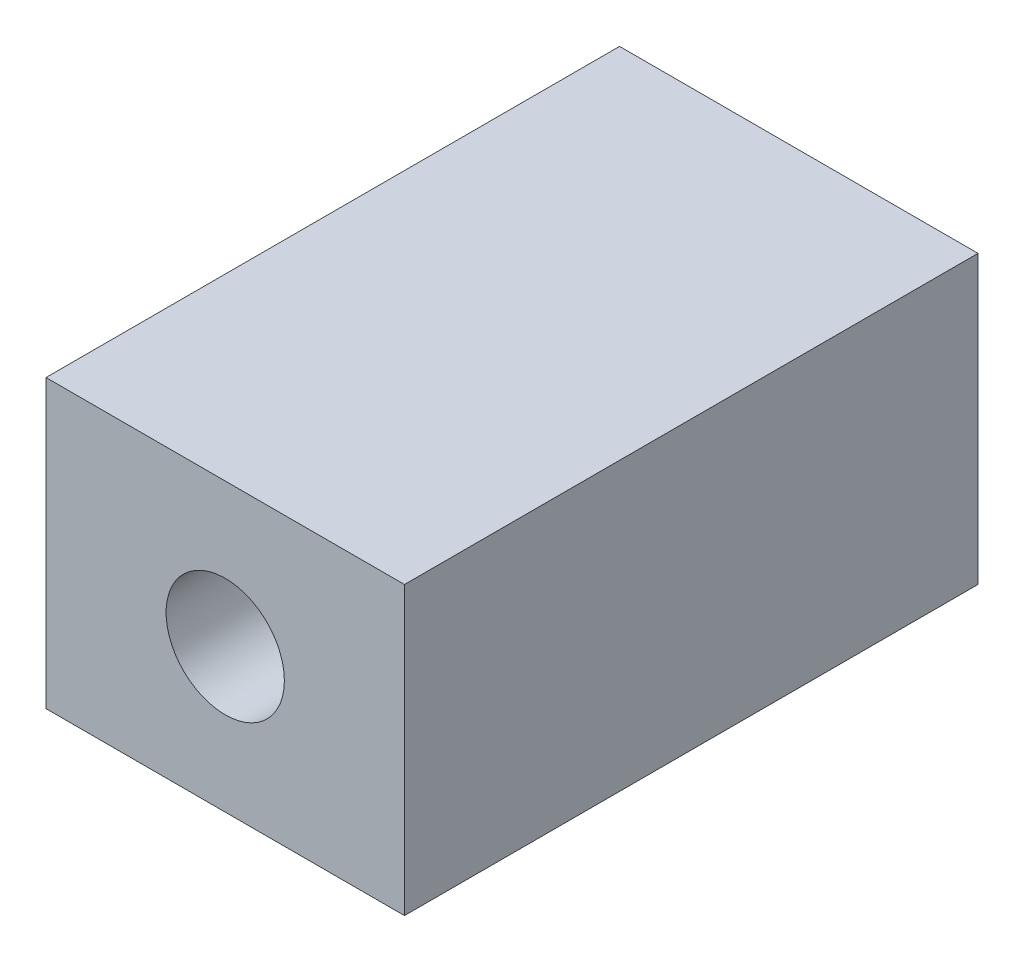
SolidWorks part; units mm, degrees
ref_plane "前视基准面" through (0, 0, 0) normal (0, 0, 1) x (1, 0, 0)
ref_plane "上视基准面" through (0, 0, 0) normal (0, 1, 0) x (1, 0, 0)
ref_plane "右视基准面" through (0, 0, 0) normal (1, 0, 0) x (0, 0, -1)
other "Configuration Table"
sketch "草图1" plane through (0, 0, 0) normal (0, 0, 1) x (1, 0, 0)
  line L1 (-5, 4) -> (5, 4)
  line L2 (-5, 4) -> (-5, -4)
  line L3 (-5, -4) -> (5, -4)
  line L4 (5, 4) -> (5, -4)
  line L5 (-5, 4) -> (5, -4) construction
  line L6 (-5, -4) -> (5, 4) construction
  point P0 (0, 0)
  dimension "D1" = 10
  dimension "D2" = 8
extrude "凸台-拉伸1" add sketch "草图1" along normal blind 16
hole_wizard "M4 螺纹孔1" positions "草图2" profile "草图3" tap size "M4" standard "GB"
sketch "草图2" plane through (0, 0, 16) normal (0, 0, 1) x (1, 0, 0)
  point P0 (0, 0)
sketch "草图3" plane through (0, 0, 16) normal (1, 0, 0) x (0, -1, 0)
  line L0 (0, 0) -> (0, 16)
  line L1 (0, 16) -> (1.65, 16)
  line L2 (1.65, 16) -> (1.65, 0)
  line L5 (1.65, 0) -> (0, 0)
  line L11 (0, -6.35) -> (0, 107.95) construction
  dimension "通孔螺纹孔钻头直径" = 3.3
  dimension "通孔螺纹孔钻头深度" = 16
